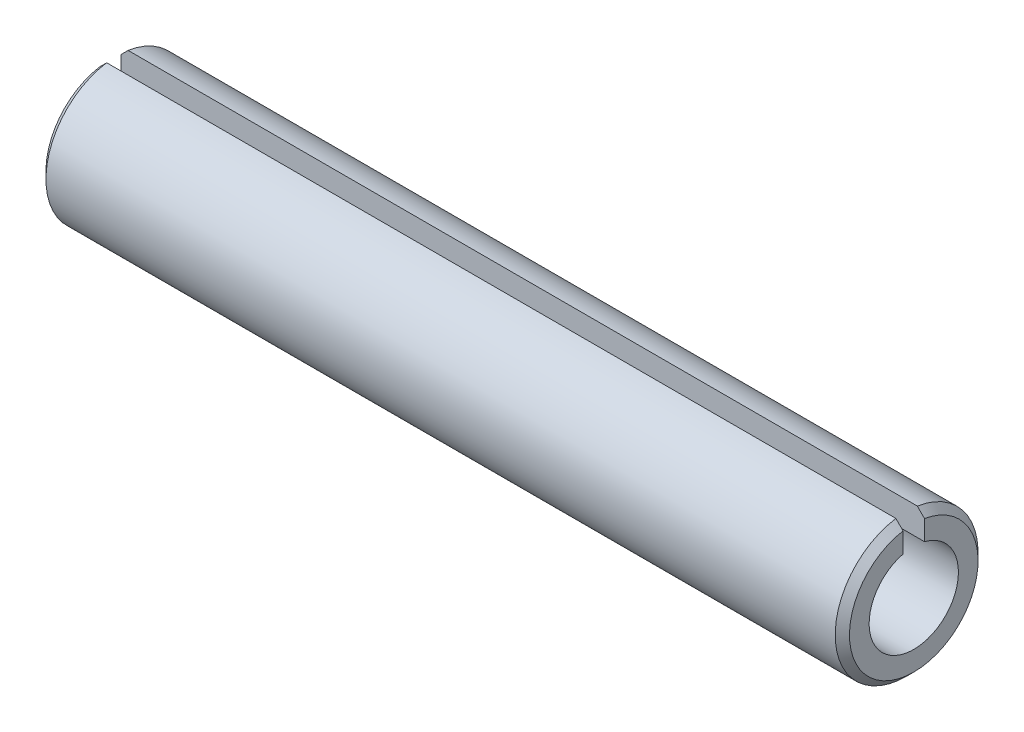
SolidWorks part; units mm, degrees
revolve "Base-Révolution" add sketch "Esquisse1" angle 360 about L6
sketch "Esquisse1" plane through (0, 0, 0) normal (0, 0, 1) x (1, 0, 0)
  line L0 (0, 2.5) -> (0, 3.6)
  line L1 (0, 2.5) -> (45, 2.5)
  line L2 (45, 2.5) -> (45, 3.6)
  line L3 (45, 3.6) -> (44.6, 4)
  line L4 (44.6, 4) -> (0.4, 4)
  line L5 (0.4, 4) -> (0, 3.6)
  line L6 (0, 0) -> (45, 0) construction
ref_plane "Plan1" through (0, 0, 0) normal (0, 0, 1) x (1, 0, 0)
ref_plane "Plan2" through (0, 0, 0) normal (0, 1, 0) x (1, 0, 0)
ref_plane "Plan3" through (0, 0, 0) normal (1, 0, 0) x (0, 0, -1)
sketch "Esquisse2" plane through (0, 0, 0) normal (1, 0, 0) x (0, 0, -1)
  line L0 (0, 0) -> (0, 4) construction
  line L1 (0.6, 3.9547) -> (0.6, 2.4269)
  line L2 (-0.6, 3.9547) -> (-0.6, 2.4269)
  circle A0 centre (0, 0) radius 4 construction
  circle A1 centre (0, 0) radius 2.5 construction
  arc A2 (0.6, 2.4269) -> (-0.6, 2.4269) centre (0, 0) ccw
  arc A3 (0.6, 3.9547) -> (-0.6, 3.9547) centre (0, 0) ccw
extrude "Enlèv. mat.-Extru.2" cut sketch "Esquisse2" along normal through all
equation "\"D6@Esquisse1\"=\"D2@Esquisse1\"/10"
equation "\"D1@Esquisse2\"=\"D3@Esquisse1\"/2.5"
